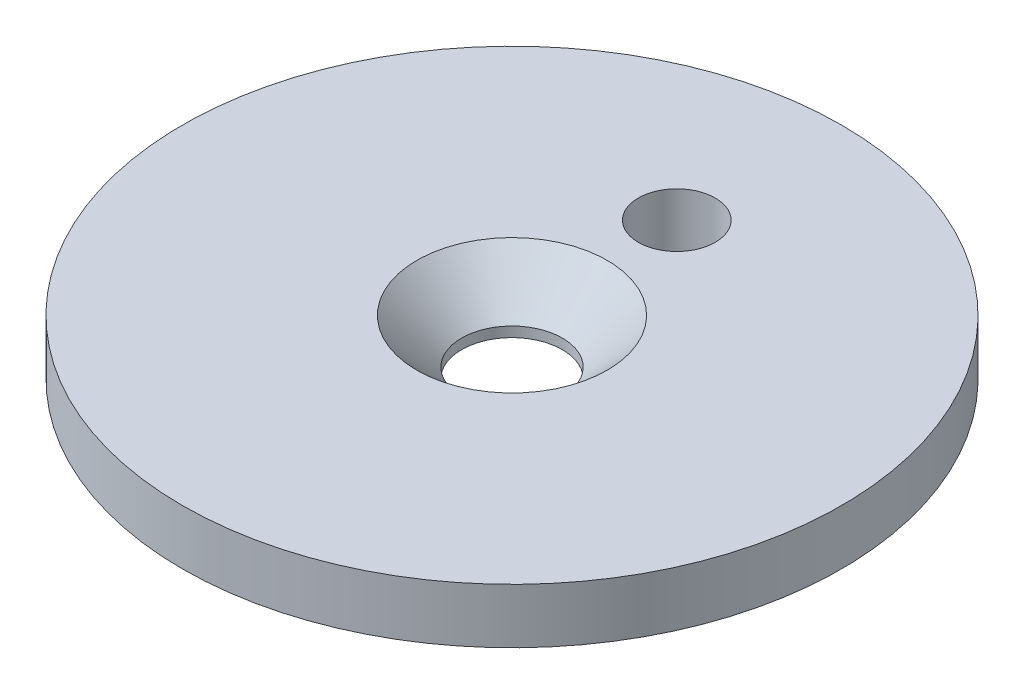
SolidWorks part; units mm, degrees
ref_plane "Front Plane" through (0, 0, 0) normal (0, 0, 1) x (1, 0, 0)
ref_plane "Top Plane" through (0, 0, 0) normal (0, 1, 0) x (1, 0, 0)
ref_plane "Right Plane" through (0, 0, 0) normal (1, 0, 0) x (0, 0, -1)
sketch "Sketch1" plane through (0, 0, 0) normal (0, 1, 0) x (1, 0, 0)
  circle A0 centre (0, 0) radius 18
  dimension "D1" = 36
extrude "Extrude1" add sketch "Sketch1" along normal blind 3
sketch "Sketch2" plane through (0, 3, 0) normal (0, 1, 0) x (1, 0, 0)
  line L0 (0, 0) -> (0, 18) construction
  circle A0 centre (0, 0) radius 18 construction
  point P5 (0, 9)
  dimension "D1" = 9
hole_wizard "M5 Tapped Hole1" positions "3DSketch1" profile "Sketch3" tap size "M5" standard "ISO"
sketch3d "3DSketch1"
  point P0 (0, 3, -9)
sketch "Sketch3" plane through (0, 3, -9) normal (1, 0, 0) x (0, 0, 1)
  line L0 (0, 0) -> (0, 3)
  line L1 (0, 3) -> (2.1, 3)
  line L2 (2.1, 3) -> (2.1, 0)
  line L5 (2.1, 0) -> (0, 0)
  line L11 (0, -6.35) -> (0, 107.95) construction
  dimension "Thru Tap Drill Dia." = 4.2
  dimension "Thru Tap Drill Depth" = 3
hole_wizard "CSK for M5 Countersunk Flat Head Screw1" positions "3DSketch2" profile "Sketch5" countersink size "M5" standard "ISO"
sketch3d "3DSketch2"
  line L0 (0, 3, 0) -> (0, 0, 0) construction
  point P0 (0, 0, 0)
  point P4 (0, 3, 0)
sketch "Sketch5" plane through (0, 3, 0) normal (1, 0, 0) x (0, 0, 1)
  line L0 (0, 0) -> (0, 3)
  line L1 (0, 3) -> (2.75, 3)
  line L2 (2.75, 3) -> (2.75, 2.45)
  line L3 (2.75, 2.45) -> (5.2, 0)
  line L5 (5.2, 0) -> (0, 0)
  line L6 (-2.75, 2.45) -> (-5.2, 0) construction
  line L11 (0, -6.35) -> (0, 107.95) construction
  dimension "Thru Hole Dia." = 5.5
  dimension "Thru Hole Depth" = 3
  dimension "Near C'Sink Dia." = 10.4
  dimension "Near C'Sink Angle" = 90
